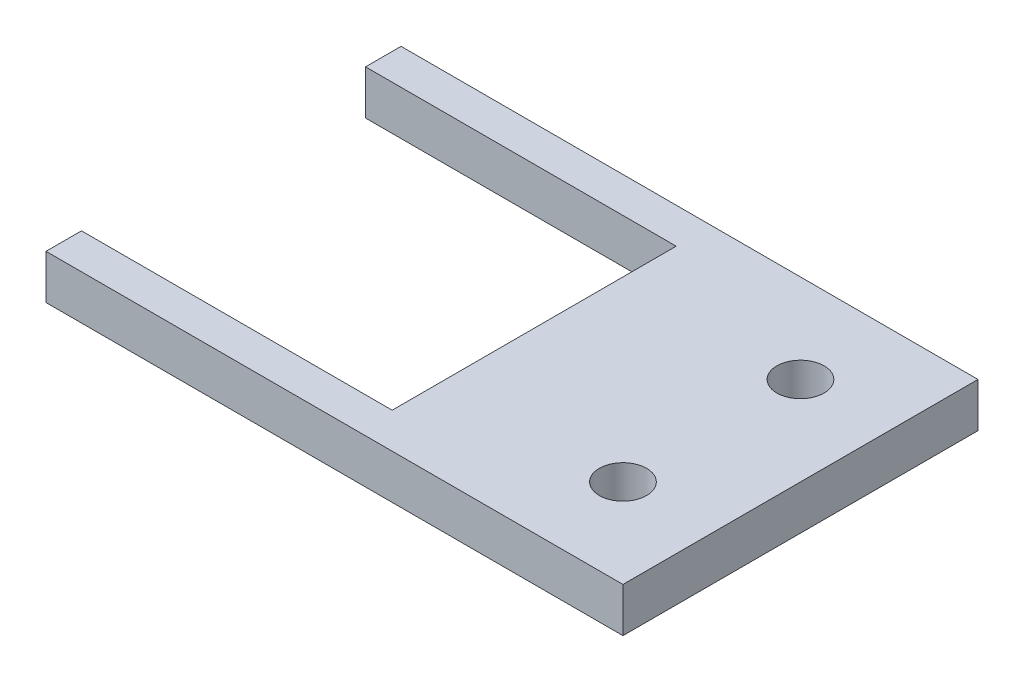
SolidWorks part; units mm, degrees
ref_plane "Front Plane" through (0, 0, 0) normal (0, 0, 1) x (1, 0, 0)
ref_plane "Top Plane" through (0, 0, 0) normal (0, 1, 0) x (1, 0, 0)
ref_plane "Right Plane" through (0, 0, 0) normal (1, 0, 0) x (0, 0, -1)
sketch "Sketch1" plane through (0, 0, 0) normal (0, 1, 0) x (1, 0, 0)
  line L1 (-43.6713, 18.9613) -> (32.5287, 18.9613)
  line L2 (-43.6713, 18.9613) -> (-43.6713, -31.8387)
  line L3 (-43.6713, -31.8387) -> (32.5287, -31.8387)
  line L4 (32.5287, 18.9613) -> (32.5287, -31.8387)
extrude "Boss-Extrude1" add sketch "Sketch1" against normal blind 6.35
sketch "Sketch2" plane through (0, 0, 0) normal (0, 1, 0) x (1, 0, 0)
  line L0 (-43.6713, 18.9613) -> (-43.6713, -31.8387) construction
  line L1 (-43.6713, 11.3413) -> (0.7787, 11.3413)
  line L2 (-43.6713, 11.3413) -> (-43.6713, -24.2187)
  line L3 (-43.6713, -24.2187) -> (0.7787, -24.2187)
  line L4 (0.7787, 11.3413) -> (0.7787, -24.2187)
  line L5 (32.5287, 18.9613) -> (-43.6713, 18.9613) construction
  dimension "D1" = 7.62
  dimension "D2" = 35.56
extrude "Cut-Extrude1" cut sketch "Sketch2" against normal blind 6.35 contours L1 L4 L3 L2
sketch "Sketch5" plane through (0, 0, 0) normal (0, 1, 0) x (1, 0, 0)
  line L0 (-43.6713, 18.9613) -> (-43.6713, 11.3413) construction
  line L1 (-43.6713, 13.8813) -> (0.7787, 13.8813)
  line L2 (-43.6713, 13.8813) -> (-43.6713, 11.3413)
  line L3 (-43.6713, 11.3413) -> (0.7787, 11.3413)
  line L4 (0.7787, 13.8813) -> (0.7787, 11.3413)
  line L5 (-43.6713, 11.3413) -> (0.7787, 11.3413) construction
  dimension "D1" = 2.54
  dimension "D2" = 0
extrude "Cut-Extrude3" cut sketch "Sketch5" against normal through all
sketch "Sketch6" plane through (0, 0, 0) normal (0, 1, 0) x (1, 0, 0)
  line L1 (-43.6713, -24.2187) -> (0.7787, -24.2187)
  line L2 (-43.6713, -24.2187) -> (-43.6713, -26.7587)
  line L3 (-43.6713, -26.7587) -> (0.7787, -26.7587)
  line L4 (0.7787, -24.2187) -> (0.7787, -26.7587)
extrude "Cut-Extrude5" cut sketch "Sketch6" against normal through all both and the other way through all
sketch "Sketch7" plane through (32.5287, 0, 0) normal (1, 0, 0) x (0, 0, -1)
  line L1 (-31.8387, 0) -> (18.9613, 0)
  line L2 (-31.8387, 0) -> (-31.8387, -6.35)
  line L3 (-31.8387, -6.35) -> (18.9613, -6.35)
  line L4 (18.9613, 0) -> (18.9613, -6.35)
extrude "Boss-Extrude2" add sketch "Sketch7" along normal blind 6.35
hole_wizard "H (0.266) Diameter Hole1" positions "Sketch10" profile "Sketch11" hole size "H" standard "ANSI Inch"
sketch "Sketch10" plane through (0, 0, 0) normal (0, 1, 0) x (1, 0, 0)
  line L0 (38.8787, 18.9613) -> (-43.6713, 18.9613) construction
  line L1 (38.8787, 18.9613) -> (38.8787, -31.8387) construction
  point P0 (26.1787, 6.2613)
  point P2 (26.1787, -19.1387)
  dimension "D1" = 25.4
  dimension "D2" = 12.7
  dimension "D3" = 12.7
sketch "Sketch11" plane through (26.1787, 0, -6.2613) normal (1, 0, 0) x (0, 0, 1)
  line L0 (0, 0) -> (0, 6.35)
  line L1 (0, 6.35) -> (3.3782, 6.35)
  line L2 (3.3782, 6.35) -> (3.3782, 0)
  line L5 (3.3782, 0) -> (0, 0)
  line L11 (0, -6.35) -> (0, 107.95) construction
  dimension "Thru Hole Dia." = 6.7564
  dimension "Thru Hole Depth" = 6.35
